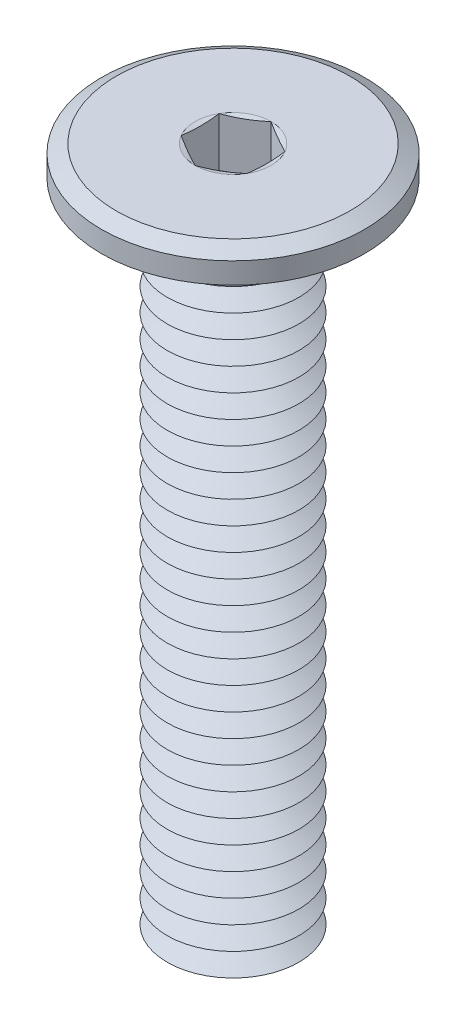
SolidWorks part; units mm, degrees
ref_plane "Front Plane" through (0, 0, 0) normal (0, 0, 1) x (1, 0, 0)
ref_plane "Top Plane" through (0, 0, 0) normal (0, 1, 0) x (1, 0, 0)
ref_plane "Right Plane" through (0, 0, 0) normal (1, 0, 0) x (0, 0, -1)
sketch "Sketch1" plane through (0, 0, 0) normal (0, 1, 0) x (1, 0, 0)
  circle A0 centre (0, 0) radius 4
  dimension "D1" = 8
extrude "Boss-Extrude1" add sketch "Sketch1" against normal blind 0.9
sketch "Sketch2" plane through (0, -0.9, 0) normal (0, -1, 0) x (1, 0, 0)
  circle A0 centre (0, 0) radius 2
  dimension "D1" = 4
extrude "Boss-Extrude2" add sketch "Sketch2" along normal blind 20
sketch "Sketch3" plane through (0, 0, 0) normal (1, 0, 0) x (0, 0, -1)
  line L0 (0, 0.9906) -> (0, -8.2999) construction
sketch "Sketch5" plane through (0, 0, 0) normal (1, 0, 0) x (0, 0, -1)
  line L0 (-2, -21.25) -> (-1.3938, -20.9)
  line L1 (-2, -0.9) -> (-2, -20.9) construction
  line L2 (-1.3938, -20.9) -> (-2, -20.55)
  line L3 (-2, -0.9) -> (-2, -20.9) construction
  line L4 (-2, -20.55) -> (-2, -21.25)
  line L6 (-2, -0.9) -> (-2, -20.9) construction
  line L7 (-2, -0.9) -> (-2, -20.9) construction
  line L14 (-2, -20.9) -> (2, -20.9) construction
  dimension "D1" = 0.7
revolve "Cut-Revolve1" cut sketch "Sketch5" angle 360 about L0
pattern_linear "LPattern1" count 27 spacing 0.7 along (0, 1, 0) of "Cut-Revolve1"
fillet "Fillet1" radius 0.2 1 edges at (0, -0.9, -2)
chamfer "Chamfer2" distance 0.45 angle 30 1 edges at (0, 0, 4)
sketch "Sketch6" plane through (0, 0, 0) normal (0, 1, 0) x (1, 0, 0)
  line L1 (0, 1.1547) -> (-1, 0.5774)
  line L2 (-1, 0.5774) -> (-1, -0.5774)
  line L3 (-1, -0.5774) -> (0, -1.1547)
  line L4 (0, -1.1547) -> (1, -0.5774)
  line L5 (1, -0.5774) -> (1, 0.5774)
  line L6 (1, 0.5774) -> (0, 1.1547)
  circle A0 centre (0, 0) radius 1 construction
  dimension "D1" = 2
extrude "Cut-Extrude1" cut sketch "Sketch6" against normal blind 1.5
sketch "Sketch7" plane through (0, -1.5, 0) normal (0, 1, 0) x (1, 0, 0)
  line L0 (-1, 0.5774) -> (-1, -0.5774) construction
  circle A0 centre (0, 0) radius 1
extrude "Cut-Extrude2" cut sketch "Sketch7" against normal through all draft 60
sketch "Sketch8" plane through (0, 0, 0) normal (0, 1, 0) x (1, 0, 0)
  circle A0 centre (0, 0) radius 1.1547
extrude "Cut-Extrude3" cut sketch "Sketch8" against normal through all draft 75
